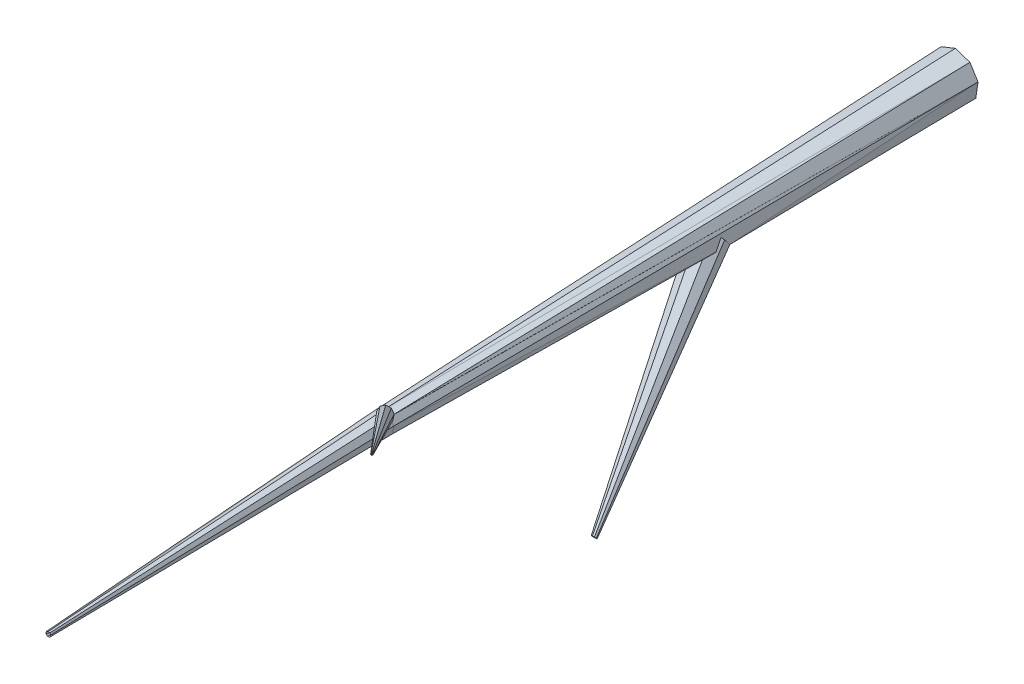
SolidWorks part; units mm, degrees
ref_plane "Front Plane" through (0, 0, 0) normal (0, 0, 1) x (1, 0, 0)
ref_plane "Top Plane" through (0, 0, 0) normal (0, 1, 0) x (1, 0, 0)
ref_plane "Right Plane" through (0, 0, 0) normal (1, 0, 0) x (0, 0, -1)
sketch3d "3DSketch1"
  point P0 (-161.8918, 166.2026, -592.4825)
sketch3d "3DSketch2"
  line L0 (-198.1465, 110.9499, -1208.775) -> (-206.4755, 150.6165, -1208.775)
  line L1 (-206.4755, 150.6165, -1208.775) -> (-187.3587, 186.3565, -1208.775)
  line L2 (-187.3587, 186.3565, -1208.775) -> (-169.7211, 120.0364, 302.2022)
  line L3 (-169.7211, 120.0364, 302.2022) -> (-178.7343, 103.1856, 302.2022)
  line L4 (-178.7343, 103.1856, 302.2022) -> (-174.8073, 84.4836, 302.2022)
  line L5 (-174.8073, 84.4836, 302.2022) -> (-198.1465, 110.9499, -1208.775)
surface "Surface-Loft1"
sketch3d "3DSketch3"
  point P0 (-140.6778, 73.3009, 302.2022)
sketch3d "3DSketch4"
  line L0 (-101.6952, 98.4683, -564.6094) -> (-95.5711, 114.2782, -1208.775)
  line L1 (-95.5711, 114.2782, -1208.775) -> (-125.7588, 87.2318, -1208.775)
  line L2 (-125.7588, 87.2318, -1208.775) -> (-166.269, 85.9174, -1208.775)
  line L3 (-166.269, 85.9174, -1208.775) -> (-159.7777, 72.6812, 302.2022)
  line L4 (-159.7777, 72.6812, 302.2022) -> (-131.958, 72.6812, 1208.775)
  line L5 (-131.958, 72.6812, 1208.775) -> (-127.6019, 72.8226, 1208.775)
  line L6 (-127.6019, 72.8226, 1208.775) -> (-124.3558, 75.7309, 1208.775)
  line L7 (-124.3558, 75.7309, 1208.775) -> (-126.4449, 86.0528, 302.2022)
  line L8 (-126.4449, 86.0528, 302.2022) -> (-115.6475, 91.4692, -75.9545)
  line L9 (-115.6475, 91.4692, -75.9545) -> (-101.6952, 98.4683, -564.6094)
surface "Surface-Loft2"
sketch3d "3DSketch5"
  point P0 (-151.9851, 127.1513, 302.2022)
sketch3d "3DSketch6"
  line L0 (-133.8252, 121.2011, 302.2022) -> (-126.039, 83.7472, 1208.775)
  line L1 (-126.039, 83.7472, 1208.775) -> (-130.1807, 85.1042, 1208.775)
  line L2 (-130.1807, 85.1042, 1208.775) -> (-169.7211, 120.0364, 302.2022)
  line L3 (-169.7211, 120.0364, 302.2022) -> (-187.3587, 186.3565, -1208.775)
  line L4 (-187.3587, 186.3565, -1208.775) -> (-149.7411, 201.447, -1208.775)
  line L5 (-149.7411, 201.447, -1208.775) -> (-111.2244, 188.8268, -1208.775)
  line L6 (-111.2244, 188.8268, -1208.775) -> (-133.5922, 121.7874, 290.9213)
  line L7 (-133.5922, 121.7874, 290.9213) -> (-133.8252, 121.2011, 302.2022)
surface "Surface-Loft3"
sketch3d "3DSketch7"
  point P0 (-154.954, 95.9711, 798.5851)
sketch3d "3DSketch8"
  line L0 (-178.7343, 103.1856, 302.2022) -> (-169.7211, 120.0364, 302.2022)
  line L1 (-169.7211, 120.0364, 302.2022) -> (-130.1807, 85.1042, 1208.775)
  line L2 (-130.1807, 85.1042, 1208.775) -> (-134.2258, 83.4815, 1208.775)
  line L3 (-134.2258, 83.4815, 1208.775) -> (-136.2814, 79.6384, 1208.775)
  line L4 (-136.2814, 79.6384, 1208.775) -> (-178.7343, 103.1856, 302.2022)
surface "Surface-Loft4"
sketch3d "3DSketch9"
  point P0 (-89.831, 154.4012, -1208.775)
sketch3d "3DSketch10"
  line L0 (-95.5711, 114.2782, -1208.775) -> (-101.6952, 98.4683, -564.6094)
  line L1 (-101.6952, 98.4683, -564.6094) -> (-123.7386, 104.9701, 302.2022)
  line L2 (-123.7386, 104.9701, 302.2022) -> (-133.8252, 121.2011, 302.2022)
surface "Surface-Loft5"
sketch3d "3DSketch11"
  line L0 (202.7267, 396.2995, 689.196) -> (202.0171, 397.8978, 688.8)
  line L1 (202.0171, 397.8978, 688.8) -> (202.3594, 399.2887, 687.896)
  line L2 (202.3594, 399.2887, 687.896) -> (203.5935, 399.8213, 686.9071)
  line L3 (203.5935, 399.8213, 686.9071) -> (205.1419, 399.2464, 686.296)
  line L4 (205.1419, 399.2464, 686.296) -> (206.2801, 397.8331, 686.3486)
  line L5 (206.2801, 397.8331, 686.3486) -> (206.4755, 396.2426, 687.0403)
  line L6 (206.4755, 396.2426, 687.0403) -> (205.6367, 395.2192, 688.0475)
  line L7 (205.6367, 395.2192, 688.0475) -> (204.1562, 395.2417, 688.8989)
  line L8 (204.1562, 395.2417, 688.8989) -> (202.7267, 396.2995, 689.196)
sketch3d "3DSketch12"
  line L0 (-158.0727, 111.2221, 310.5384) -> (-162.9614, 122.2332, 307.8098)
  line L1 (-162.9614, 122.2332, 307.8098) -> (-160.6029, 131.8153, 301.5819)
  line L2 (-160.6029, 131.8153, 301.5819) -> (-152.1009, 135.4846, 294.769)
  line L3 (-152.1009, 135.4846, 294.769) -> (-141.4336, 131.5243, 290.5588)
  line L4 (-141.4336, 131.5243, 290.5588) -> (-133.5922, 121.7874, 290.9213)
  line L5 (-133.5922, 121.7874, 290.9213) -> (-132.246, 110.83, 295.687)
  line L6 (-132.246, 110.83, 295.687) -> (-138.0247, 103.7791, 302.6258)
  line L7 (-138.0247, 103.7791, 302.6258) -> (-148.2245, 103.9339, 308.4911)
  line L8 (-148.2245, 103.9339, 308.4911) -> (-158.0727, 111.2221, 310.5384)
surface "Surface-Loft6"
sketch3d "3DSketch13"
  line L0 (-111.2966, -395.0405, -208.1234) -> (-109.3117, -392.058, -205.7816)
  line L1 (-109.3117, -392.058, -205.7816) -> (-105.1268, -390.5546, -204.8166)
  line L2 (-105.1268, -390.5546, -204.8166) -> (-100.7001, -391.2337, -205.6798)
  line L3 (-100.7001, -391.2337, -205.6798) -> (-98.1028, -393.7775, -207.9674)
  line L4 (-98.1028, -393.7775, -207.9674) -> (-98.5503, -396.9958, -210.609)
  line L5 (-98.5503, -396.9958, -210.609) -> (-101.8331, -399.3826, -212.3685)
  line L6 (-101.8331, -399.3826, -212.3685) -> (-106.4153, -399.8213, -212.4227)
  line L7 (-106.4153, -399.8213, -212.4227) -> (-110.1527, -398.1064, -210.7462)
  line L8 (-110.1527, -398.1064, -210.7462) -> (-111.2966, -395.0405, -208.1234)
sketch3d "3DSketch14"
  line L0 (-181.3596, 110.6891, -549.0746) -> (-168.9542, 129.3292, -534.4385)
  line L1 (-168.9542, 129.3292, -534.4385) -> (-142.7987, 138.7255, -528.4068)
  line L2 (-142.7987, 138.7255, -528.4068) -> (-115.1316, 134.4813, -533.802)
  line L3 (-115.1316, 134.4813, -533.802) -> (-98.8985, 118.5825, -548.0995)
  line L4 (-98.8985, 118.5825, -548.0995) -> (-101.6952, 98.4683, -564.6094)
  line L5 (-101.6952, 98.4683, -564.6094) -> (-122.213, 83.5505, -575.6065)
  line L6 (-122.213, 83.5505, -575.6065) -> (-150.8514, 80.8091, -575.9451)
  line L7 (-150.8514, 80.8091, -575.9451) -> (-174.2102, 91.527, -565.4669)
  line L8 (-174.2102, 91.527, -565.4669) -> (-181.3596, 110.6891, -549.0746)
surface "Surface-Loft7"
sketch3d "3DSketch15"
  spline S0 degree 2 poles (-166.269, 85.9174, -1208.775) (-181.0031, 68.7088, 0.5113) (-131.958, 72.6812, 1208.775) knots 0 0 0 1 1 1
sketch3d "3DSketch16"
  spline S0 degree 2 poles (-198.1465, 110.9499, -1208.775) (-200.6286, 84.1249, 0.873) (-135.3858, 75.373, 1208.775) knots 0 0 0 1 1 1
surface "Surface-Loft8"
sketch3d "3DSketch17"
  line L0 (-126.4449, 86.0528, 302.2022) -> (-123.7386, 104.9701, 302.2022)
  line L1 (-123.7386, 104.9701, 302.2022) -> (-133.8252, 121.2011, 302.2022)
sketch3d "3DSketch18"
  line L0 (-124.3558, 75.7309, 1208.775) -> (-123.7386, 80.0453, 1208.775)
  line L1 (-123.7386, 80.0453, 1208.775) -> (-126.039, 83.7472, 1208.775)
surface "Surface-Loft9"
ref_plane "Plane1" through (-162.1447, -34.0463, 6.7086) normal (0.9779, 0.2053, -0.0405) x (-0.0396, -0.0083, -0.9992)
sketch "Sketch1" plane through (-162.1447, -34.0463, 6.7086) normal (0.9779, 0.2053, -0.0405) x (-0.0396, -0.0083, -0.9992)
  line L0 (-295.7358, 137.7123) -> (-1203.0514, 105.9437)
  line L1 (-1203.0514, 105.9437) -> (-1203.0514, 101.5853)
  line L2 (-1203.0514, 101.5853) -> (-295.7358, 118.6024)
  line L3 (-295.7358, 118.6024) -> (-295.7358, 137.7123)
surface "Surface-Plane1" sketch "Sketch1"
ref_plane "Plane2" through (-128.036, 18.3171, -3.3934) normal (-0.9896, 0.1416, -0.0262) x (-0.026, 0.0037, 0.9997)
sketch "Sketch2" plane through (-128.036, 18.3171, -3.3934) normal (-0.9896, 0.1416, -0.0262) x (-0.026, 0.0037, 0.9997)
  line L0 (305.7008, 67.2784) -> (305.7008, 86.3882)
  line L1 (305.7008, 86.3882) -> (-561.4091, 83.0738)
  line L2 (-561.4091, 83.0738) -> (-72.5861, 74.1693)
  line L3 (-72.5861, 74.1693) -> (305.7008, 67.2784)
surface "Surface-Plane2" sketch "Sketch2"
ref_plane "Plane3" through (-32.7723, -20.3659, -1.3992) normal (-0.8488, -0.5275, -0.0362) x (-0.0308, -0.0191, 0.9993)
sketch "Sketch3" plane through (-32.7723, -20.3659, -1.3992) normal (-0.8488, -0.5275, -0.0362) x (-0.0308, -0.0191, 0.9993)
  line L0 (-1208.1693, 178.5562) -> (292.5127, 173.9537)
  line L1 (292.5127, 173.9537) -> (-1208.1693, 219.0877)
  line L2 (-1208.1693, 219.0877) -> (-1208.1693, 178.5562)
surface "Surface-Plane3" sketch "Sketch3"
